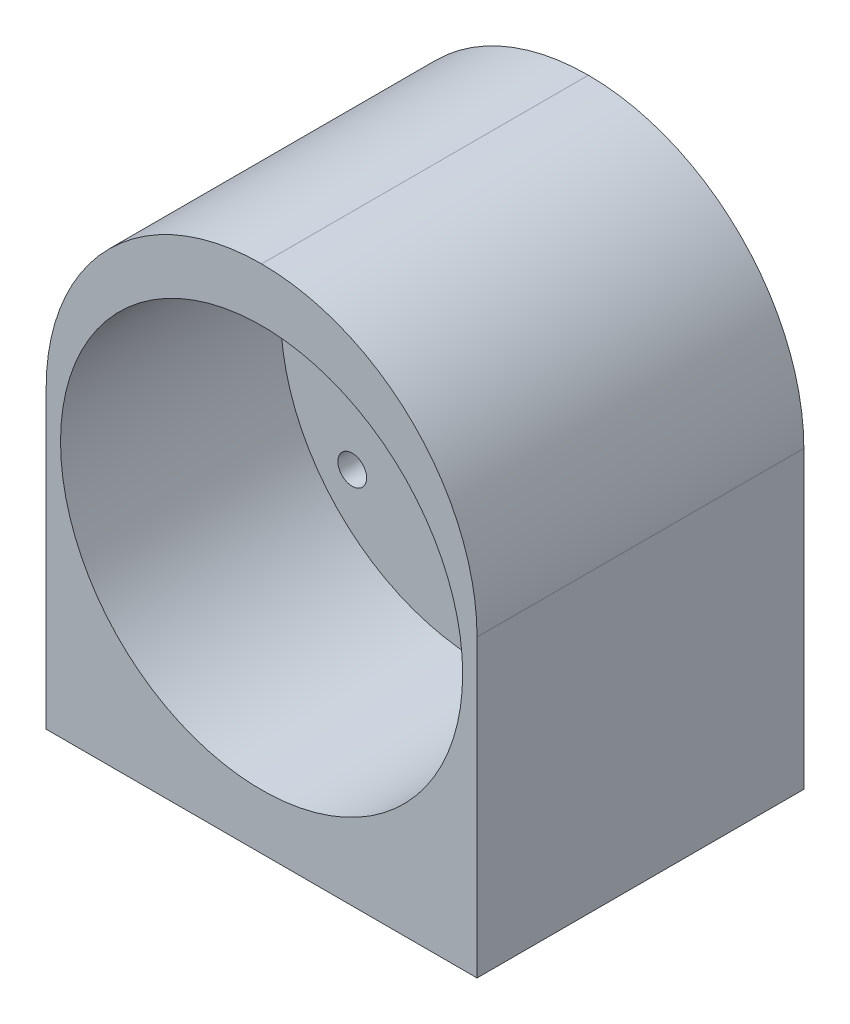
SolidWorks part; units mm, degrees
ref_plane "前视基准面" through (0, 0, 0) normal (0, 0, 1) x (1, 0, 0)
ref_plane "上视基准面" through (0, 0, 0) normal (0, 1, 0) x (1, 0, 0)
ref_plane "右视基准面" through (0, 0, 0) normal (1, 0, 0) x (0, 0, -1)
sketch "草图1" plane through (0, 0, 0) normal (0, 1, 0) x (1, 0, 0)
  line L0 (-32.236, -21.9963) -> (12.768, -21.9963)
  line L1 (12.768, -21.9963) -> (12.768, 12.1359)
  line L2 (12.768, 12.1359) -> (-32.236, 12.1359)
  line L3 (-32.236, 12.1359) -> (-32.236, -21.9963)
extrude "凸台-拉伸2" add sketch "草图1" along normal blind 53.34
sketch "草图11" plane through (0, 0, 0) normal (0, 0, 1) x (1, 0, 0)
  circle A0 centre (-9.734, 26.7536) radius 21
sketch "草图16" plane through (0, 0, 0) normal (0, 0, 1) x (1, 0, 0)
  circle A0 centre (-9.734, 26.7536) radius 21
extrude "切除-拉伸2" cut sketch "草图16" along normal blind 22 and the other way blind 1
sketch "草图26" plane through (0, 0, 0) normal (0, 0, 1) x (1, 0, 0)
  circle A0 centre (3.7955, 16.462) radius 1.5
  circle A1 centre (-23.2635, 16.462) radius 1.5
  circle A2 centre (3.7955, 37.0452) radius 1.5
  circle A4 centre (-23.2635, 37.0452) radius 1.5
extrude "切除-拉伸3" cut sketch "草图26" against normal blind 13
fillet "圆角2" radius 22.5 1 edges at (-32.236, 53.34, 4.9302)
fillet "圆角4" radius 22.5 1 edges at (12.768, 53.34, 4.9302)
sketch "草图28" plane through (0, 0, 0) normal (0, -1, 0) x (-1, 0, 0)
  circle A0 centre (25.2338, -12.9826) radius 1.5
  circle A1 centre (25.2338, 3.1408) radius 1.5
  circle A2 centre (-5.7674, 3.1408) radius 1.5
  circle A3 centre (-5.7674, -12.9826) radius 1.5
extrude "切除-拉伸4" cut sketch "草图28" against normal blind 10
sketch "草图29" plane through (0, 0, 0) normal (0, 0, 1) x (1, 0, 0)
  circle A0 centre (-9.734, 26.7536) radius 5
extrude "切除-拉伸13" cut sketch "草图29" along normal blind 1 and the other way blind 32
